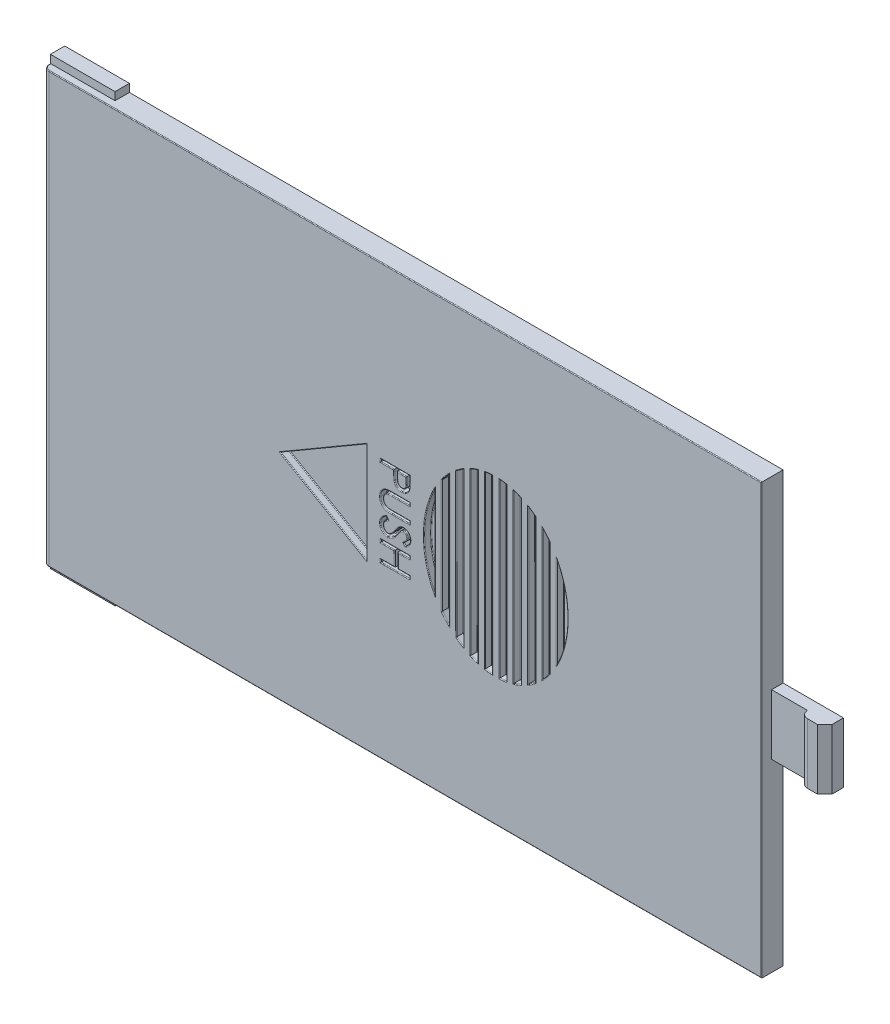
SolidWorks part; units mm, degrees
ref_plane "Plan de face" through (0, 0, 0) normal (0, 0, 1) x (1, 0, 0)
ref_plane "Plan de dessus" through (0, 0, 0) normal (0, 1, 0) x (1, 0, 0)
ref_plane "Plan de droite" through (0, 0, 0) normal (1, 0, 0) x (0, 0, -1)
sketch "Esquisse1" plane through (0, 0, 0) normal (0, 0, 1) x (1, 0, 0)
  line L1 (0, 0) -> (50, 0)
  line L2 (0, 0) -> (0, 29.9)
  line L3 (0, 29.9) -> (50, 29.9)
  line L4 (50, 0) -> (50, 29.9)
  dimension "D1" = 29.9
  dimension "D2" = 50
extrude "Extrusion1" add sketch "Esquisse1" along normal blind 1.5
sketch "Esquisse2" plane through (50, 0, 0) normal (1, 0, 0) x (0, 0, -1)
  line L1 (0, 12.85) -> (-0.8, 12.85)
  line L2 (0, 12.85) -> (0, 17.05)
  line L3 (0, 17.05) -> (-0.8, 17.05)
  line L4 (-0.8, 12.85) -> (-0.8, 17.05)
  line L5 (-1.5, 29.9) -> (0, 29.9) construction
  point P6 (-0.75, 29.9)
  dimension "D1" = 4.2
  dimension "D2" = 0.8
  dimension "D3" = 12.85
extrude "Extrusion2" add sketch "Esquisse2" along normal blind 4.2
sketch "Esquisse3" plane through (0, 0, 0.8) normal (0, 0, 1) x (1, 0, 0)
  line L1 (52.5, 17.05) -> (54.2, 17.05)
  line L2 (52.5, 17.05) -> (52.5, 12.85)
  line L3 (52.5, 12.85) -> (54.2, 12.85)
  line L4 (54.2, 17.05) -> (54.2, 12.85)
  line L5 (50, 0) -> (50, 29.9) construction
  dimension "D1" = 2.5
extrude "Extrusion3" add sketch "Esquisse3" along normal blind 0.5
chamfer "Chanfrein1" distance 0.5 1 edges at (54.2, 14.95, 1.3)
sketch "Esquisse4" plane through (0, 0, 0) normal (0, 0, -1) x (-1, 0, 0)
  line L0 (-54.2, 12.85) -> (-54.2, 17.05) construction
  line L1 (-52.4, 15.45) -> (-47.4, 15.45)
  line L2 (-52.4, 15.45) -> (-52.4, 14.45)
  line L3 (-52.4, 14.45) -> (-47.4, 14.45)
  line L4 (-47.4, 15.45) -> (-47.4, 14.45)
  line L5 (-54.2, 17.05) -> (-50, 17.05) construction
  line L6 (-54.2, 12.85) -> (-50, 12.85) construction
  point P4 (-54.2, 14.95)
  dimension "D1" = 1
  dimension "D2" = 5
  dimension "D3" = 1.8
  dimension "D4" = 1.6
  dimension "D5" = 1.6
extrude "Extrusion4" add sketch "Esquisse4" along normal blind 0.7
fillet "Congé1" radius 0.5 1 edges at (52.5, 14.95, 1.3)
fillet "Congé5" radius 0.4 1 edges at (52.4, 14.45, -0.35)
fillet "Congé6" radius 0.4 1 edges at (52.4, 15.45, -0.35)
fillet "Congé7" radius 0.4 1 edges at (47.4, 14.45, -0.35)
fillet "Congé8" radius 0.4 1 edges at (47.4, 15.45, -0.35)
fillet "Congé9" radius 0.4 8 edges at (47.5172, 14.5672, -0.7) (49.9, 14.45, -0.7) (52.2828, 14.5672, -0.7) (52.4, 14.95, -0.7) (52.2828, 15.3328, -0.7) (49.9, 15.45, -0.7) (47.5172, 15.3328, -0.7) (47.4, 14.95, -0.7)
sketch "Esquisse5" plane through (0, 29.9, 0) normal (0, 1, 0) x (-1, 0, 0)
  line L1 (0, 0) -> (-4.5, 0)
  line L2 (0, 0) -> (0, 1)
  line L3 (0, 1) -> (-4.5, 1)
  line L4 (-4.5, 0) -> (-4.5, 1)
  dimension "D1" = 4.5
  dimension "D2" = 1
extrude "Extrusion5" add sketch "Esquisse5" along normal blind 0.55
ref_plane "Plan1" through (0, 14.95, 0) normal (0, -1, 0) x (1, 0, 0)
mirror "Symétrie1" about plane through (0, 14.95, 0) normal (0, -1, 0) of "Extrusion5"
fillet "Congé10" radius 0.4 1 edges at (0, 14.95, 1.5)
sketch "Esquisse6" plane through (0, 0, 1.5) normal (0, 0, 1) x (1, 0, 0)
  line L0 (50, 14.95) -> (0, 14.95) construction
  line L1 (50, 0) -> (50, 29.9) construction
  line L2 (0, 29.9) -> (0, 0) construction
  line L3 (16.5, 14.95) -> (22.5, 18.45)
  line L4 (22.5, 18.45) -> (22.5, 11.45)
  line L5 (16.5, 14.95) -> (22.5, 11.45)
  line L6 (23.5, 18.45) -> (23.5, 11.45) construction
  line L7 (26.5, 20.95) -> (26.5, 8.95) construction
  line L8 (26.5, 8.95) -> (36.5, 8.95) construction
  line L9 (36.5, 8.95) -> (36.5, 20.95) construction
  line L10 (36.5, 20.95) -> (26.5, 20.95) construction
  line L11 (31.5, 20.95) -> (31.5, 8.95) construction
  line L12 (31.75, 20.9425) -> (31.75, 8.9575)
  line L13 (32.25, 20.8821) -> (32.25, 9.0179)
  line L14 (32.75, 20.7595) -> (32.75, 9.1405)
  line L15 (33.25, 20.5705) -> (33.25, 9.3295)
  line L16 (33.75, 20.3082) -> (33.75, 9.5918)
  line L17 (34.25, 19.961) -> (34.25, 9.939)
  line L18 (34.75, 19.5096) -> (34.75, 10.3904)
  line L19 (35.25, 18.9186) -> (35.25, 10.9814)
  line L20 (35.75, 18.1107) -> (35.75, 11.7893)
  line L21 (27.25, 18.1107) -> (27.25, 11.7893)
  line L22 (36.25, 21.8804) -> (36.25, 7.5901)
  line L23 (27.75, 18.9186) -> (27.75, 10.9814)
  line L24 (28.25, 19.5096) -> (28.25, 10.3904)
  line L25 (28.75, 19.961) -> (28.75, 9.939)
  line L26 (29.25, 20.3082) -> (29.25, 9.5918)
  line L27 (29.75, 20.5705) -> (29.75, 9.3295)
  line L28 (30.25, 20.7595) -> (30.25, 9.1405)
  line L29 (30.75, 20.8821) -> (30.75, 9.0179)
  line L30 (31.25, 20.9425) -> (31.25, 8.9575)
  ellipse E0 centre (31.5, 14.95) end of major axis (31.5, 20.95) minor radius 5 (31.25, 8.9575) -> (30.75, 9.0179) cw
  ellipse E1 centre (31.5, 14.95) end of major axis (31.5, 20.95) minor radius 5 (32.25, 20.8821) -> (31.75, 20.9425) ccw
  ellipse E2 centre (31.5, 14.95) end of major axis (31.5, 20.95) minor radius 5 (30.25, 9.1405) -> (29.75, 9.3295) cw
  ellipse E3 centre (31.5, 14.95) end of major axis (31.5, 20.95) minor radius 5 (33.25, 20.5705) -> (32.75, 20.7595) ccw
  ellipse E4 centre (31.5, 14.95) end of major axis (31.5, 20.95) minor radius 5 (35.25, 18.9186) -> (34.75, 19.5096) ccw
  ellipse E5 centre (31.5, 14.95) end of major axis (31.5, 20.95) minor radius 5 (34.25, 19.961) -> (33.75, 20.3082) ccw
  ellipse E6 centre (31.5, 14.95) end of major axis (31.5, 20.95) minor radius 5 (34.75, 10.3904) -> (35.25, 10.9814) ccw
  ellipse E7 centre (31.5, 14.95) end of major axis (31.5, 20.95) minor radius 5 (35.75, 11.7893) -> (35.75, 18.1107) ccw
  ellipse E8 centre (31.5, 14.95) end of major axis (31.5, 20.95) minor radius 5 (29.25, 9.5918) -> (28.75, 9.939) cw
  ellipse E9 centre (31.5, 14.95) end of major axis (31.5, 20.95) minor radius 5 (33.75, 9.5918) -> (34.25, 9.939) ccw
  ellipse E10 centre (31.5, 14.95) end of major axis (31.5, 20.95) minor radius 5 (27.25, 11.7893) -> (27.25, 18.1107) cw
  ellipse E11 centre (31.5, 14.95) end of major axis (31.5, 20.95) minor radius 5 (32.75, 9.1405) -> (33.25, 9.3295) ccw
  ellipse E12 centre (31.5, 14.95) end of major axis (31.5, 20.95) minor radius 5 (28.25, 10.3904) -> (27.75, 10.9814) cw
  ellipse E13 centre (31.5, 14.95) end of major axis (31.5, 20.95) minor radius 5 (31.75, 8.9575) -> (32.25, 9.0179) ccw
  ellipse E14 centre (31.5, 14.95) end of major axis (31.5, 20.95) minor radius 5 (28.75, 19.961) -> (29.25, 20.3082) cw
  ellipse E15 centre (31.5, 14.95) end of major axis (31.5, 20.95) minor radius 5 (27.75, 18.9186) -> (28.25, 19.5096) cw
  ellipse E16 centre (31.5, 14.95) end of major axis (31.5, 20.95) minor radius 5 (29.75, 20.5705) -> (30.25, 20.7595) cw
  ellipse E17 centre (31.5, 14.95) end of major axis (31.5, 20.95) minor radius 5 (30.75, 20.8821) -> (31.25, 20.9425) cw
  text T0 "PUSH" font "Century Gothic" height 2
  dimension "D1" = 3.5
  dimension "D2" = 7
  dimension "D3" = 6
  dimension "D4" = 16.5
  dimension "D5" = 1
  dimension "D6" = 3
  dimension "D7" = 10
  dimension "D8" = 12
  dimension "D9" = 6
  dimension "D10" = 0.5
  dimension "D11" = 0.25
extrude "Enlèv. mat.-Extru.1" cut sketch "Esquisse6" against normal blind 0.5
fillet "Congé11" radius 0.05 95 edges at (19.5, 16.7, 1) (22.5, 14.95, 1) (19.5, 13.2, 1) (35.75, 14.95, 1) (36.5, 14.95, 1) (35.25, 14.95, 1) (35.0087, 10.6753, 1) (34.75, 14.95, 1) (35.0087, 19.2247, 1) (34.25, 14.95, 1) (34.0042, 9.7567, 1) (33.75, 14.95, 1) (34.0042, 20.1433, 1) (33.25, 14.95, 1) (33.0021, 9.2271, 1) (32.75, 14.95, 1) (33.0021, 20.6729, 1) (32.25, 14.95, 1) (32.0006, 8.9802, 1) (31.75, 14.95, 1) (32.0006, 20.9198, 1) (30.75, 14.95, 1) (30.9994, 20.9198, 1) (31.25, 14.95, 1) (30.9994, 8.9802, 1) (29.75, 14.95, 1) (29.9979, 20.6729, 1) (30.25, 14.95, 1) (29.9979, 9.2271, 1) (28.75, 14.95, 1) (28.9958, 20.1433, 1) (29.25, 14.95, 1) (28.9958, 9.7567, 1) (27.75, 14.95, 1) (27.9913, 19.2247, 1) (28.25, 14.95, 1) (27.9913, 10.6753, 1) (27.25, 14.95, 1) (26.5, 14.95, 1) (25.5, 13.1167, 1) (25.0897, 13.0269, 1) (24.6795, 12.5141, 1) (25.0897, 12.0013, 1) (25.5, 11.9115, 1) (24.5, 11.8218, 1) (23.5, 11.9115, 1) (23.9872, 12.0013, 1) (24.4744, 12.5141, 1) (23.9872, 13.0269, 1) (23.5, 13.1167, 1) (24.5, 13.2064, 1) (23.9365, 14.7116, 1) (25.1512, 13.7234, 1) (25.5, 16.3218, 1) (24.9008, 16.2321, 1) (24.9008, 15.309, 1) (25.5, 15.2192, 1) (24.896, 15.1295, 1) (24.896, 16.4115, 1) (25.5, 17.8565, 1) (24.4231, 17.8016, 1) (23.9615, 17.8731, 1) (23.5, 17.9628, 1) (24.5, 18.0526, 1) (25.2949, 17.6902, 1) (24.9615, 17.8731, 1) (24.626, 17.698, 1)
fillet "Congé12" radius 0.05 102 edges at (0.1172, 0, 1.3828) (0.1172, 29.9, 1.3828) (23.5, 13.1167, 1.5) (23.9872, 13.0269, 1.5) (24.4744, 12.5141, 1.5) (23.9872, 12.0013, 1.5) (23.5, 11.9115, 1.5) (24.5, 11.8218, 1.5) (25.5, 11.9115, 1.5) (25.0897, 12.0013, 1.5) (24.6795, 12.5141, 1.5) (25.0897, 13.0269, 1.5) (25.5, 13.1167, 1.5) (24.5, 13.2064, 1.5) (24.896, 15.1295, 1.5) (25.5, 15.2192, 1.5) (24.9008, 15.309, 1.5) (24.9008, 16.2321, 1.5) (25.5, 16.3218, 1.5) (24.896, 16.4115, 1.5) (50, 14.95, 1.5) (25.2, 0, 1.5) (25.2, 29.9, 1.5) (23.5, 17.9628, 1.5) (23.9615, 17.8731, 1.5) (24.4231, 17.8016, 1.5) (25.5, 17.8565, 1.5) (24.5, 18.0526, 1.5) (25.1512, 13.7234, 1.5) (23.9365, 14.7116, 1.5) (19.5, 16.7, 1.5) (19.5, 13.2, 1.5) (22.5, 14.95, 1.5) (32.0006, 8.9802, 1.5) (32.25, 14.95, 1.5) (32.0006, 20.9198, 1.5) (31.75, 14.95, 1.5) (30.9994, 20.9198, 1.5) (30.75, 14.95, 1.5) (30.9994, 8.9802, 1.5) (31.25, 14.95, 1.5) (33.0021, 9.2271, 1.5) (33.25, 14.95, 1.5) (33.0021, 20.6729, 1.5) (32.75, 14.95, 1.5) (35.0087, 10.6753, 1.5) (35.25, 14.95, 1.5) (35.0087, 19.2247, 1.5) (34.75, 14.95, 1.5) (34.0042, 9.7567, 1.5) (34.25, 14.95, 1.5) (34.0042, 20.1433, 1.5) (33.75, 14.95, 1.5) (36.5, 14.95, 1.5) (35.75, 14.95, 1.5) (29.9979, 20.6729, 1.5) (29.75, 14.95, 1.5) (29.9979, 9.2271, 1.5) (30.25, 14.95, 1.5) (28.9958, 20.1433, 1.5) (28.75, 14.95, 1.5) (28.9958, 9.7567, 1.5) (29.25, 14.95, 1.5) (26.5, 14.95, 1.5) (27.25, 14.95, 1.5) (27.9913, 19.2247, 1.5) (27.75, 14.95, 1.5) (27.9913, 10.6753, 1.5) (28.25, 14.95, 1.5) (24.626, 17.698, 1.5) (24.9615, 17.8731, 1.5) (25.2949, 17.6902, 1.5)
